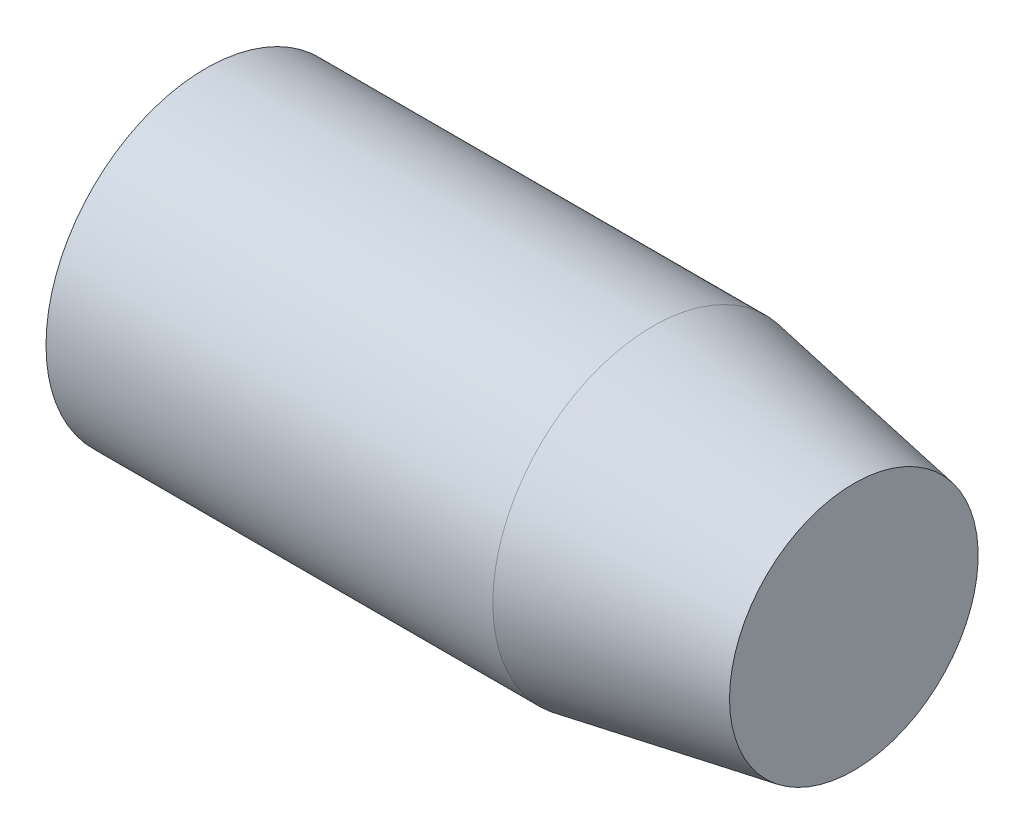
SolidWorks part; units mm, degrees
ref_plane "Front Plane" through (0, 0, 0) normal (0, 0, 1) x (1, 0, 0)
ref_plane "Top Plane" through (0, 0, 0) normal (0, 1, 0) x (1, 0, 0)
ref_plane "Right Plane" through (0, 0, 0) normal (1, 0, 0) x (0, 0, -1)
sketch "Sketch1" plane through (0, 0, 0) normal (0, 0, 1) x (1, 0, 0)
  line L0 (0, 0) -> (4.826, 0)
  line L1 (0, 0) -> (0, 1.19)
  line L2 (0, 0) -> (7.1104, 0) construction
  line L3 (0, 0) -> (0, 5.1781) construction
  line L4 (0, 1.19) -> (3.3274, 1.19)
  line L5 (3.3274, 1.19) -> (4.826, 0.9258)
  line L6 (4.826, 0.9258) -> (4.826, 0)
  line L7 (3.81, 0) -> (3.81, 1.1049) construction
  point P12 (5.6711, 0)
  dimension "D1" = 4.826
  dimension "D2" = 2.38
  dimension "D3" = 10
  dimension "D4" = 1.016
  dimension "D5" = 2.2098
revolve "Revolve1" add sketch "Sketch1" angle 360 about L0
